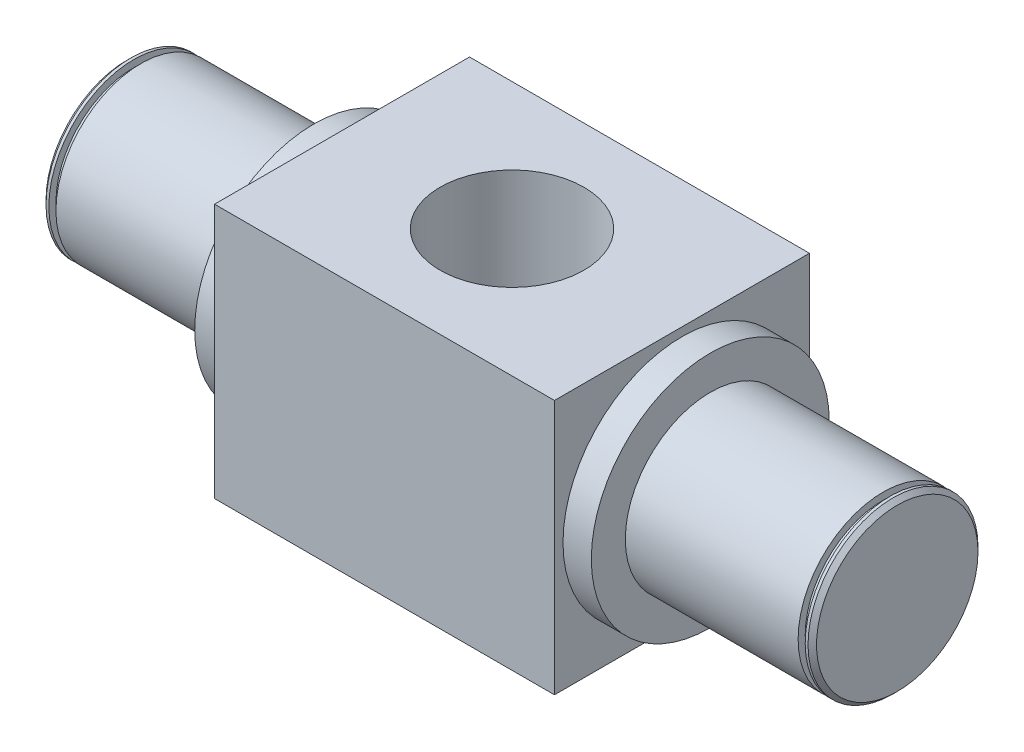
SolidWorks part; units mm, degrees
ref_plane "Front Plane" through (0, 0, 0) normal (0, 0, 1) x (1, 0, 0)
ref_plane "Top Plane" through (0, 0, 0) normal (0, 1, 0) x (1, 0, 0)
ref_plane "Right Plane" through (0, 0, 0) normal (1, 0, 0) x (0, 0, -1)
sketch "Sketch1" plane through (0, 0, 0) normal (0, 1, 0) x (1, 0, 0)
  line L1 (-30, 22.5) -> (30, 22.5)
  line L2 (-30, 22.5) -> (-30, -22.5)
  line L3 (-30, -22.5) -> (30, -22.5)
  line L4 (30, 22.5) -> (30, -22.5)
  line L5 (-30, 22.5) -> (30, -22.5) construction
  line L6 (-30, -22.5) -> (30, 22.5) construction
  circle A0 centre (0, 0) radius 12.7
  dimension "D1" = 25.4
  dimension "D2" = 45
  dimension "D3" = 60
extrude "Boss-Extrude1" add sketch "Sketch1" along normal blind 45
sketch "Sketch2" plane through (30, 0, 0) normal (1, 0, 0) x (0, 0, -1)
  line L0 (-22.5, 0) -> (22.5, 45) construction
  circle A0 centre (0, 22.5) radius 15
  dimension "D1" = 30
extrude "Boss-Extrude2" add sketch "Sketch2" along normal blind 38
sketch "Sketch3" plane through (-30, 0, 0) normal (-1, 0, 0) x (0, 0, 1)
  circle A1 centre (0, 22.5) radius 15
  circle A2 centre (0, 22.5) radius 15
  dimension "D1" = 0
extrude "Boss-Extrude3" add sketch "Sketch3" along normal blind 38
sketch "Sketch4" plane through (30, 0, 0) normal (1, 0, 0) x (0, 0, -1)
  circle A0 centre (0, 22.5) radius 21
  dimension "D1" = 42
extrude "Boss-Extrude4" add sketch "Sketch4" along normal blind 5
sketch "Sketch5" plane through (-30, 0, 0) normal (-1, 0, 0) x (0, 0, 1)
  circle A1 centre (0, 22.5) radius 21
  circle A2 centre (0, 22.5) radius 21
  dimension "D1" = 0
extrude "Boss-Extrude5" add sketch "Sketch5" along normal blind 5
chamfer "Chamfer1" distance 0.75 angle 45 2 edges at (68, 22.5, -15) (-68, 22.5, 15)
sketch "Sketch6" plane through (-68, 0, 0) normal (-1, 0, 0) x (0, 0, 1)
  circle A1 centre (0, 22.5) radius 15 construction
  circle A2 centre (0, 22.5) radius 13.75
  circle A3 centre (0, 22.5) radius 13.75
  circle A4 centre (0, 22.5) radius 15
  dimension "D1" = 1.25
extrude "Cut-Extrude1" cut sketch "Sketch6" along normal blind 1.25 from offset 2.5
mirror "Mirror1" about plane through (0, 0, 0) normal (1, 0, 0) of "Cut-Extrude1"
